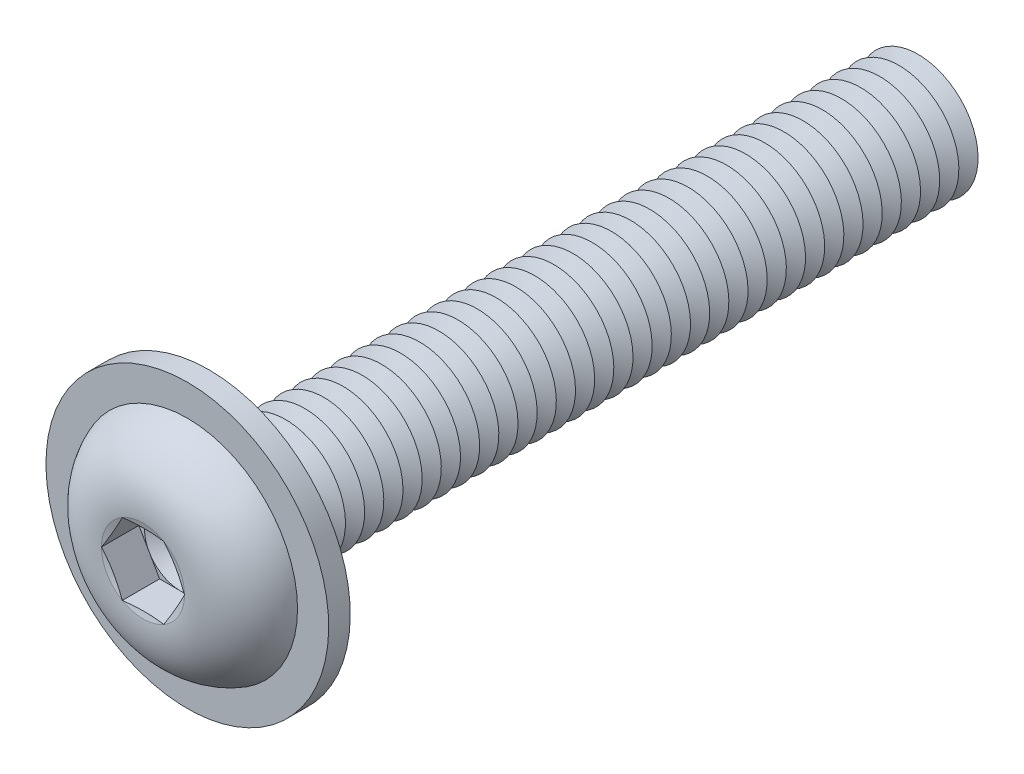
SolidWorks part; units mm, degrees
ref_plane "Front Plane" through (0, 0, 0) normal (0, 0, 1) x (1, 0, 0)
ref_plane "Top Plane" through (0, 0, 0) normal (0, 1, 0) x (1, 0, 0)
ref_plane "Right Plane" through (0, 0, 0) normal (1, 0, 0) x (0, 0, -1)
sketch "Sketch1" plane through (0, 0, 0) normal (1, 0, 0) x (0, 0, -1)
  line L0 (0, 2.5) -> (0, 4.75)
  line L3 (0, 2.5) -> (30, 2.5)
  line L4 (30, 2.5) -> (30, 0)
  line L5 (30, 0) -> (-2.75, 0) construction
  line L6 (-2.75, 0) -> (30, 0)
  line L7 (-2.75, 1.732) -> (-2.75, 0.866) construction
  line L8 (-2.75, 0.866) -> (-2.75, 0)
  line L9 (-2.75, 1.732) -> (-2.5179, 0.866)
  line L10 (-2.5179, 0.866) -> (-2.75, 0.866)
  line L11 (30, 0) -> (22.7481, 0) construction
  line L12 (0, 4.75) -> (-2.75, 4.75) construction
  arc A1 (0, 4.75) -> (-2.75, 1.732) centre (0, 1.9881) ccw
  point P8 (30, 1.25)
  dimension "D1" = 9.5
  dimension "D2" = 5
  dimension "D3" = 2.75
  dimension "D4" = 3.4641
  dimension "D5" = 30
  dimension "D6" = 15
revolve "Revolve1" add sketch "Sketch1" angle 360 about L5
fillet "Fillet1" radius 0.4 1 edges at (0, 2.5, 0)
sketch "Sketch2" plane through (0, 0, 0) normal (1, 0, 0) x (0, 0, -1)
  line L0 (29.6, 2.5) -> (30.4, 2.5)
  line L1 (30, 2.5) -> (0.4, 2.5) construction
  line L2 (30.4, 2.5) -> (30, 1.8072)
  line L3 (30, -2.5) -> (30, 2.5) construction
  line L4 (30, 1.8072) -> (29.6, 2.5)
  dimension "D1" = 0.8
revolve "Cut-Revolve1" cut sketch "Sketch2" angle 360 about axis through (0, 0, -30) along (0, 0, -1)
pattern_linear "LPattern1" count 37 spacing 0.8 along (0, 0, 1) of "Cut-Revolve1"
sketch "Sketch3" plane through (0, 0, 2.75) normal (0, 0, 1) x (1, 0, 0)
  line L7 (0.866, 1.5) -> (-0.866, 1.5)
  line L8 (-0.866, 1.5) -> (-1.7321, 0)
  line L9 (-1.7321, 0) -> (-0.866, -1.5)
  line L10 (-0.866, -1.5) -> (0.866, -1.5)
  line L11 (0.866, -1.5) -> (1.732, 0)
  line L12 (1.732, 0) -> (0.866, 1.5)
  circle A0 centre (0, 0) radius 1.5 construction
  circle A3 centre (0, 0) radius 1.7321 construction
extrude "Cut-Extrude1" cut sketch "Sketch3" against normal blind 1.56
sketch "Sketch4" plane through (0, 0, 1.19) normal (0, 0, 1) x (1, 0, 0)
  line L1 (0.866, 1.5) -> (-0.866, 1.5) construction
  circle A0 centre (0, 0) radius 1.5
extrude "Cut-Extrude2" cut sketch "Sketch4" against normal through all draft 60
sketch "Sketch5" plane through (0, 0, 0) normal (0, 0, -1) x (-1, 0, 0)
  circle A0 centre (0, 0) radius 5.9
  circle A1 centre (0, 0) radius 2.9
  circle A2 centre (0, 0) radius 2.9 construction
  dimension "D1" = 11.8
extrude "Boss-Extrude1" add sketch "Sketch5" against normal blind 0.9
